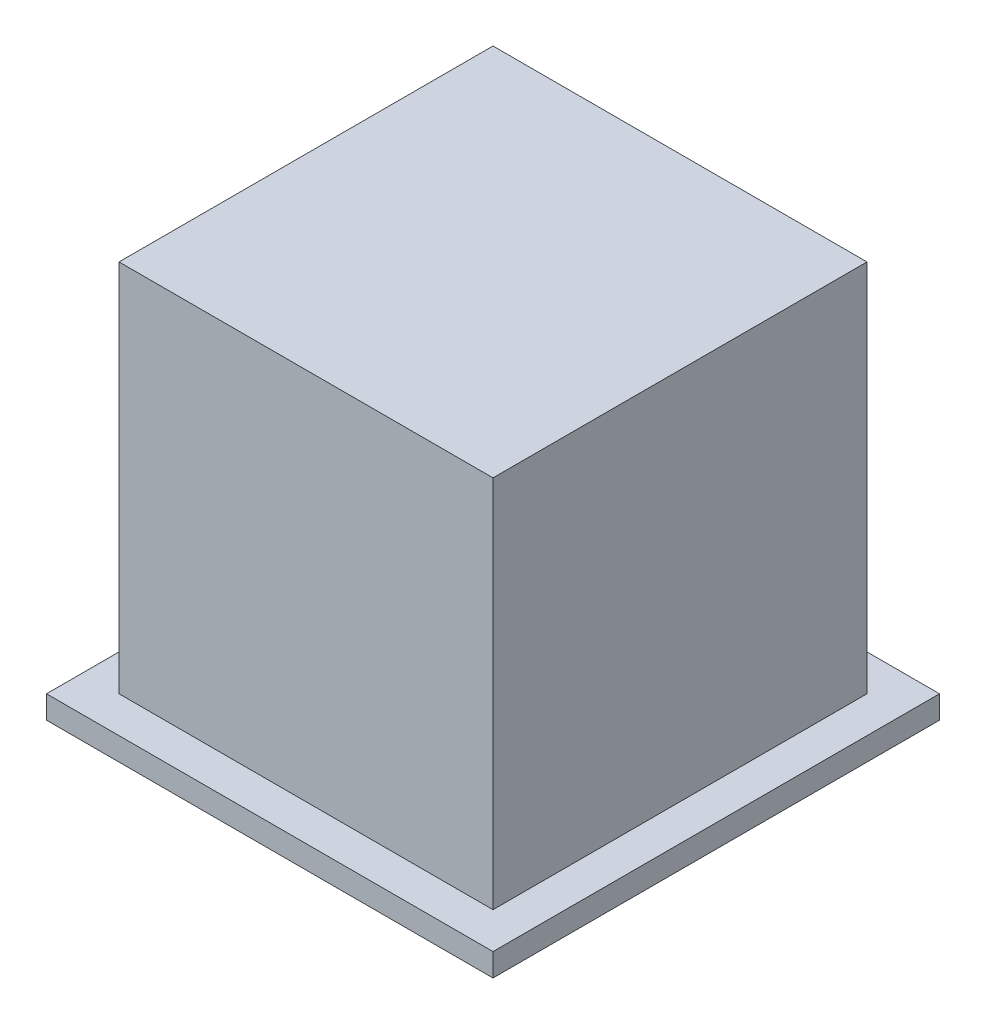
SolidWorks part; units mm, degrees
ref_plane "Front Plane" through (0, 0, 0) normal (0, 0, 1) x (1, 0, 0)
ref_plane "Top Plane" through (0, 0, 0) normal (0, 1, 0) x (1, 0, 0)
ref_plane "Right Plane" through (0, 0, 0) normal (1, 0, 0) x (0, 0, -1)
sketch "Sketch1" plane through (0, 0, 0) normal (0, 1, 0) x (1, 0, 0)
  line L0 (-24.5, 24.5) -> (24.5, 24.5)
  line L1 (-21.5, 21.5) -> (21.5, 21.5)
  line L2 (-21.5, 21.5) -> (-21.5, -21.5)
  line L3 (-21.5, -21.5) -> (21.5, -21.5)
  line L4 (21.5, 21.5) -> (21.5, -21.5)
  line L5 (-21.5, 21.5) -> (21.5, -21.5) construction
  line L6 (-21.5, -21.5) -> (21.5, 21.5) construction
  line L7 (24.5, 24.5) -> (24.5, -24.5)
  line L8 (-24.5, -24.5) -> (24.5, -24.5)
  line L9 (-24.5, 24.5) -> (-24.5, -24.5)
  point P0 (0, 0)
  dimension "D1" = 43
  dimension "D2" = 43
  dimension "D3" = 3
extrude "Boss-Extrude1" add sketch "Sketch1" along normal blind 49
sketch "Sketch2" plane through (0, 49, 0) normal (0, 1, 0) x (1, 0, 0)
  line L1 (-24.5, 24.5) -> (24.5, 24.5)
  line L2 (-24.5, 24.5) -> (-24.5, -24.5)
  line L3 (-24.5, -24.5) -> (24.5, -24.5)
  line L4 (24.5, 24.5) -> (24.5, -24.5)
extrude "Boss-Extrude2" add sketch "Sketch2" along normal blind 3
sketch "Sketch3" plane through (0, 0, 0) normal (0, -1, 0) x (1, 0, 0)
  line L0 (-29.25, 29.25) -> (29.25, 29.25)
  line L1 (-24.5, 24.5) -> (24.5, 24.5)
  line L2 (-24.5, 24.5) -> (-24.5, -24.5)
  line L3 (-24.5, -24.5) -> (24.5, -24.5)
  line L4 (24.5, 24.5) -> (24.5, -24.5)
  line L5 (29.25, 29.25) -> (29.25, -29.25)
  line L6 (-29.25, -29.25) -> (29.25, -29.25)
  line L7 (-29.25, 29.25) -> (-29.25, -29.25)
  dimension "D1" = 4.75
extrude "Boss-Extrude3" add sketch "Sketch3" against normal blind 3
sketch "Sketch4" plane through (0, 0, -24.5) normal (0, 0, -1) x (-1, 0, 0)
  line L0 (-24.5, 52) -> (24.5, 52) construction
  line L1 (-5.5, 49) -> (5.5, 49)
  line L2 (-5.5, 49) -> (-5.5, 43)
  line L3 (-5.5, 43) -> (5.5, 43)
  line L4 (5.5, 49) -> (5.5, 43)
  line L5 (0, 52) -> (0, -2.0413) construction
  dimension "D1" = 3
  dimension "D2" = 6
  dimension "D3" = 11
  dimension "D4" = 5.5
extrude "Cut-Extrude1" cut sketch "Sketch4" against normal blind 6.58
sketch "Sketch5" plane through (0, 0, -21.5) normal (0, 0, 1) x (1, 0, 0)
  line L0 (21.5, 0) -> (-21.5, 0) construction
  line L1 (-5.5, 43) -> (5.5, 43)
  line L2 (-5.5, 43) -> (-5.5, 0)
  line L3 (-5.5, 0) -> (5.5, 0)
  line L4 (5.5, 43) -> (5.5, 0)
extrude "Cut-Extrude2" cut sketch "Sketch5" against normal blind 10.71
